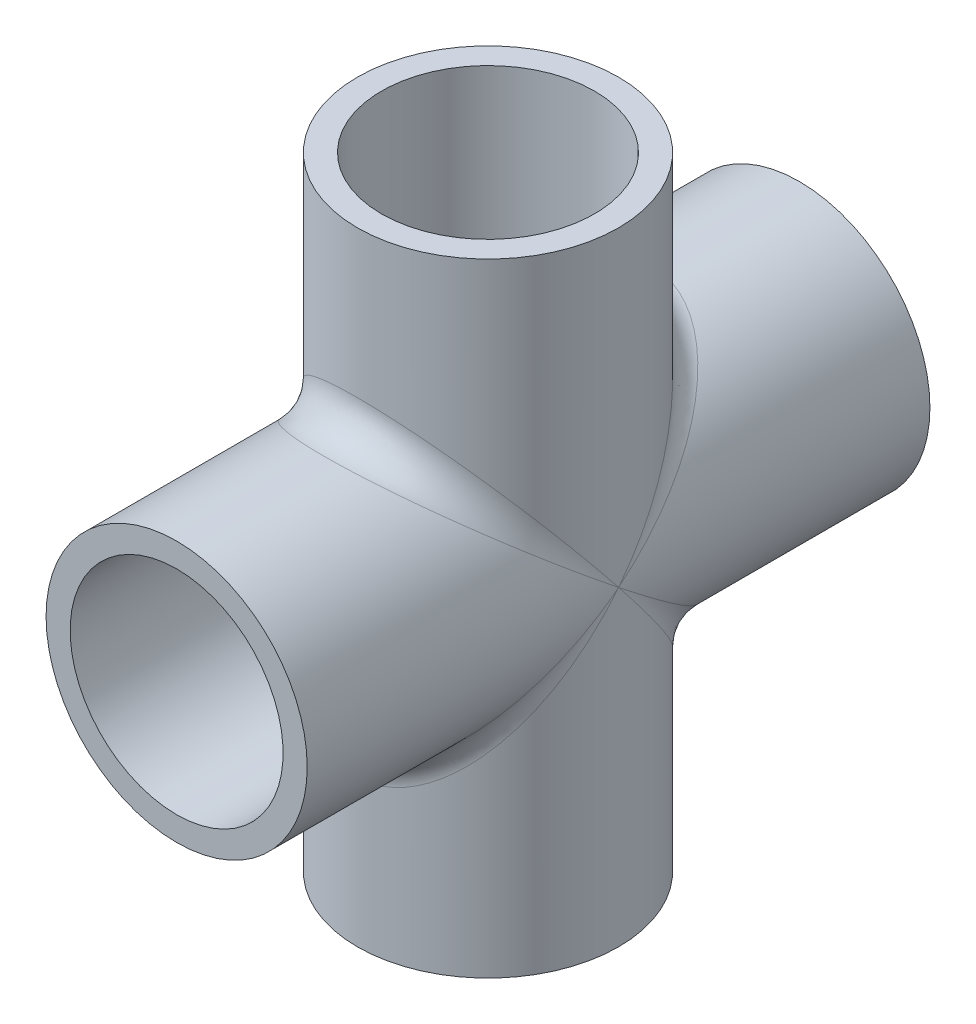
SolidWorks part; units mm, degrees
ref_plane "Front Plane" through (0, 0, 0) normal (0, 0, 1) x (1, 0, 0)
ref_plane "Top Plane" through (0, 0, 0) normal (0, 1, 0) x (1, 0, 0)
ref_plane "Right Plane" through (0, 0, 0) normal (1, 0, 0) x (0, 0, -1)
sketch "Sketch1" plane through (0, 0, 0) normal (1, 0, 0) x (0, 0, -1)
  line L0 (0, 0) -> (-49.2125, 0) construction
  line L1 (0, 0) -> (49.2125, 0) construction
  line L2 (0, 0) -> (0, 49.2125) construction
  line L3 (-20.6375, -13.3223) -> (-20.6375, 13.3223) construction
  line L4 (-13.3223, 20.6375) -> (13.3223, 20.6375) construction
  line L5 (20.6375, -13.3223) -> (20.6375, 13.3223) construction
  line L6 (-49.2125, -20.6375) -> (-49.2125, 20.6375) construction
  line L7 (49.2125, -20.6375) -> (49.2125, 20.6375) construction
  line L8 (20.6375, 49.2125) -> (-20.6375, 49.2125) construction
  line L9 (-20.6375, 13.3223) -> (-49.2125, 13.3223) construction
  line L10 (-13.3223, 20.6375) -> (-13.3223, 49.2125) construction
  line L11 (20.6375, 13.3223) -> (49.2125, 13.3223) construction
  line L12 (-34.925, -16.8275) -> (-34.925, 16.8275) construction
  line L13 (-16.8275, 34.925) -> (16.8275, 34.925) construction
  line L14 (34.925, -16.8275) -> (34.925, 16.8275) construction
  line L15 (0, 0) -> (0, -49.2125) construction
  line L16 (-20.6375, -49.2125) -> (20.6375, -49.2125) construction
  line L17 (-13.3223, -20.6375) -> (13.3223, -20.6375) construction
  line L18 (-16.8275, -34.925) -> (16.8275, -34.925) construction
  line L19 (13.3223, -20.6375) -> (13.3223, -49.2125) construction
  point P4 (0, 0)
  point P10 (-20.6375, 0)
  point P13 (0, 20.6375)
  point P16 (20.6375, 0)
  point P19 (-49.2125, 0)
  point P22 (49.2125, 0)
  point P25 (0, 49.2125)
  point P27 (-34.925, 13.3223)
  point P31 (-34.925, 0)
  point P34 (0, 34.925)
  point P37 (34.925, 0)
  point P38 (-13.3223, 34.925)
  point P39 (34.925, 13.3223)
  point P42 (0, -49.2125)
  point P46 (0, -20.6375)
  point P49 (0, -34.925)
  point P50 (13.3223, -34.925)
sketch "Sketch2" plane through (0, 0, 0) normal (1, 0, 0) x (0, 0, -1)
  line L0 (-49.2125, 20.6375) -> (49.2125, 20.6375)
  line L1 (49.2125, 20.6375) -> (49.2125, 0)
  line L2 (49.2125, -20.6375) -> (49.2125, 20.6375) construction
  line L8 (-49.2125, -20.6375) -> (-49.2125, 20.6375) construction
  line L9 (-49.2125, 0) -> (-49.2125, 20.6375)
  line L10 (-49.2125, 0) -> (49.2125, 0)
revolve "Revolve1" add sketch "Sketch2" angle 360 about L0
sketch "Sketch3" plane through (0, 0, 0) normal (1, 0, 0) x (0, 0, -1)
  line L0 (0, 49.2125) -> (20.6375, 49.2125)
  line L1 (20.6375, 49.2125) -> (20.6375, -49.2125)
  line L3 (20.6375, -49.2125) -> (0, -49.2125)
  line L4 (0, -49.2125) -> (0, 49.2125)
revolve "Revolve2" add sketch "Sketch3" angle 360 about L2
sketch "Sketch4" plane through (0, 0, 0) normal (1, 0, 0) x (0, 0, -1)
  line L0 (-49.2125, 16.8275) -> (-20.6375, 16.8275)
  line L1 (-49.2125, -20.6375) -> (-49.2125, 20.6375) construction
  line L2 (-20.6375, 16.8275) -> (-20.6375, 13.3223)
  line L3 (-20.6375, 13.3223) -> (20.6375, 13.3223)
  line L4 (20.6375, 13.3223) -> (20.6375, 16.8275)
  line L5 (20.6375, 16.8275) -> (49.2125, 16.8275)
  line L6 (49.2125, -20.6375) -> (49.2125, 20.6375) construction
  line L7 (49.2125, 16.8275) -> (49.2125, 0)
  line L8 (49.2125, 0) -> (-49.2125, 0)
  line L9 (-49.2125, 0) -> (-49.2125, 16.8275)
revolve "Cut-Revolve1" cut sketch "Sketch4" angle 360 about L8
sketch "Sketch5" plane through (0, 0, 0) normal (1, 0, 0) x (0, 0, -1)
  line L0 (0, 49.2125) -> (0, -49.2125)
  line L1 (20.6375, 49.2125) -> (-20.6375, 49.2125) construction
  line L3 (0, -49.2125) -> (-16.8275, -49.2125)
  line L5 (-13.3223, -20.6375) -> (-13.3223, 20.6375)
  line L6 (-13.3223, 20.6375) -> (-16.8275, 20.6375)
  line L7 (-16.8275, 20.6375) -> (-16.8275, 49.2125)
  line L8 (-16.8275, 49.2125) -> (0, 49.2125)
  line L9 (-20.6375, -49.2125) -> (20.6375, -49.2125) construction
  line L10 (-16.8275, -49.2125) -> (-16.8275, -20.6375)
  line L11 (-16.8275, -20.6375) -> (-13.3223, -20.6375)
revolve "Cut-Revolve2" cut sketch "Sketch5" angle 360 about L0
fillet "Fillet1" radius 5.3258 4 edges at (0, -20.6375, 20.6375) (0, 20.6375, -20.6375) (0, -20.6375, -20.6375) (0, 20.6375, 20.6375)
sketch "Sketch6" plane through (0, 0, 0) normal (1, 0, 0) x (0, 0, -1)
  line L0 (-49.2125, 16.8275) -> (-20.6375, 16.8275)
  line L1 (-49.2125, -20.6375) -> (-49.2125, 20.6375) construction
  line L2 (-20.6375, 16.8275) -> (-20.6375, 13.3223)
  line L3 (-20.6375, 13.3223) -> (-13.3223, 13.3223)
  line L4 (-13.3223, 13.3223) -> (-13.3223, 20.6375)
  line L5 (-13.3223, 20.6375) -> (-16.8275, 20.6375)
  line L6 (-16.8275, 20.6375) -> (-16.8275, 49.2125)
  line L7 (20.6375, 49.2125) -> (-20.6375, 49.2125) construction
  line L8 (-20.6375, -13.3223) -> (-13.3223, -13.3223)
  line L9 (20.6375, -13.3223) -> (20.6375, -16.8275)
  line L10 (20.6375, -16.8275) -> (49.2125, -16.8275)
  line L11 (49.2125, -20.6375) -> (49.2125, 20.6375) construction
  line L12 (-20.6375, -13.3223) -> (-20.6375, -16.8275)
  line L13 (-20.6375, -16.8275) -> (-49.2125, -16.8275)
  line L14 (49.2125, 16.8275) -> (20.6375, 16.8275)
  line L15 (20.6375, 16.8275) -> (20.6375, 13.3223)
  line L16 (20.6375, 13.3223) -> (13.3223, 13.3223)
  line L17 (13.3223, 13.3223) -> (13.3223, 20.6375)
  line L18 (13.3223, 20.6375) -> (16.8275, 20.6375)
  line L19 (16.8275, 20.6375) -> (16.8275, 49.2125)
  line L20 (-13.3223, -20.6375) -> (-13.3223, -13.3223)
  line L21 (13.3223, -20.6375) -> (13.3223, -13.3223)
  line L22 (16.8275, -49.2125) -> (16.8275, -20.6375)
  line L23 (-20.6375, -49.2125) -> (20.6375, -49.2125) construction
  line L24 (16.8275, -20.6375) -> (13.3223, -20.6375)
  line L25 (-16.8275, -49.2125) -> (-16.8275, -20.6375)
  line L26 (-16.8275, -20.6375) -> (-13.3223, -20.6375)
  line L27 (13.3223, -13.3223) -> (20.6375, -13.3223)
sketch "Sketch7" plane through (0, 0, 49.2125) normal (0, 0, 1) x (1, 0, 0)
  circle A0 centre (0, 0) radius 16.8275 construction
  circle A1 centre (0, 0) radius 16.8275
  point P3 (0, -16.8275)
  point P4 (16.8275, 0)
  point P5 (-16.8275, 0)
  point P6 (0, 16.8275)
equation "\"D1@Fillet1\"=\"Tee OD@Sketch1\"*0.1290322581"
equation "\"D2@Sketch1\"=\"Vert Center to Socket@Sketch1\""
equation "\"Horz Leg Length@Sketch1\" = \"Horz Length@Sketch1\" / 2"
equation "\"Vert Leg Length@Sketch1\"=\"Vert Length@Sketch1\"/2"
equation "\"D1@Sketch1\"=\"Horz Center to Socket@Sketch1\""
